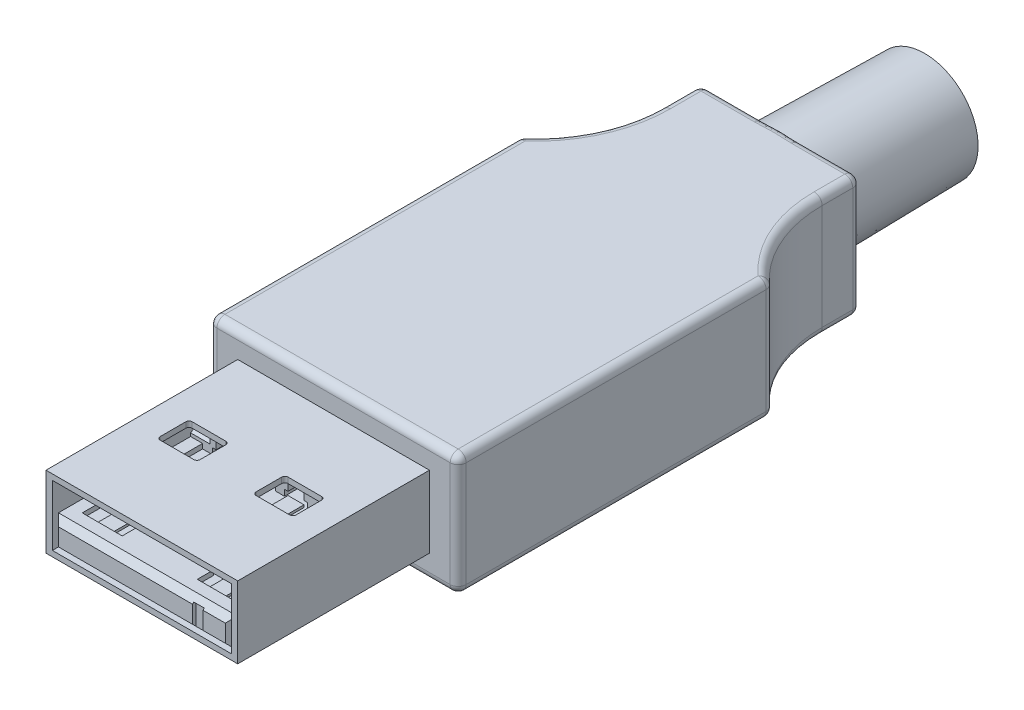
SolidWorks part; units mm, degrees
ref_plane "Front" through (0, 0, 0) normal (0, 0, 1) x (1, 0, 0)
ref_plane "Top" through (0, 0, 0) normal (0, 1, 0) x (1, 0, 0)
ref_plane "Right" through (0, 0, 0) normal (1, 0, 0) x (0, 0, -1)
imported_body "Импортированный1"
sketch "Эскиз1" plane through (0, 0, 0) normal (0, 1, 0) x (1, 0, 0)
  line L0 (0, 0) -> (0, 40) construction
  line L1 (5, 37.5795) -> (5, 40)
  line L2 (7.8, 12) -> (-7.8, 12)
  line L3 (-7.8, 12) -> (-7.8, 31.5)
  line L4 (-5, 37.5795) -> (-5, 40)
  line L5 (-5, 40) -> (5, 40)
  line L6 (6, 0) -> (-6, 0) construction
  line L7 (7.8, 12) -> (7.8, 31.5)
  arc A0 (-5, 37.5795) -> (-7.8, 31.5) centre (-13, 37.5795) cw
  arc A1 (5, 37.5795) -> (7.8, 31.5) centre (13, 37.5795) ccw
  point P16 (0, 12)
  dimension "D7" = 8
  dimension "D1" = 15.6
  dimension "D2" = 12
  dimension "D3" = 19.5
  dimension "D4" = 40
  dimension "D5" = 10
  dimension "D6" = 2.4205
extrude "Вытянуть1" add sketch "Эскиз1" along normal mid plane 7.6
sketch "Эскиз2" plane through (0, 0, -40) normal (0, 0, -1) x (-1, 0, 0)
  circle A0 centre (0, 0) radius 3.5
  dimension "D1" = 7
extrude "Вытянуть2" add sketch "Эскиз2" along normal blind 9 draft 1
fillet "Скругление1" radius 0.5 22 edges at (0, -3.8, -12) (7.8, -3.8, -21.75) (5.7336, -3.8, -34.2328) (5, -3.8, -38.7897) (0, -3.8, -40) (-5, -3.8, -38.7897) (-5.7336, -3.8, -34.2328) (-7.8, -3.8, -21.75) (-5.7336, 3.8, -34.2328) (-5, 3.8, -38.7897) (0, 3.8, -40) (5, 3.8, -38.7897) (5.7336, 3.8, -34.2328) (7.8, 3.8, -21.75) (0, 3.8, -12) (-7.8, 3.8, -21.75) (-7.8, 0, -31.5) (7.8, 0, -31.5) (5, 0, -40) (-5, 0, -40) (-7.8, 0, -12) (7.8, 0, -12)
